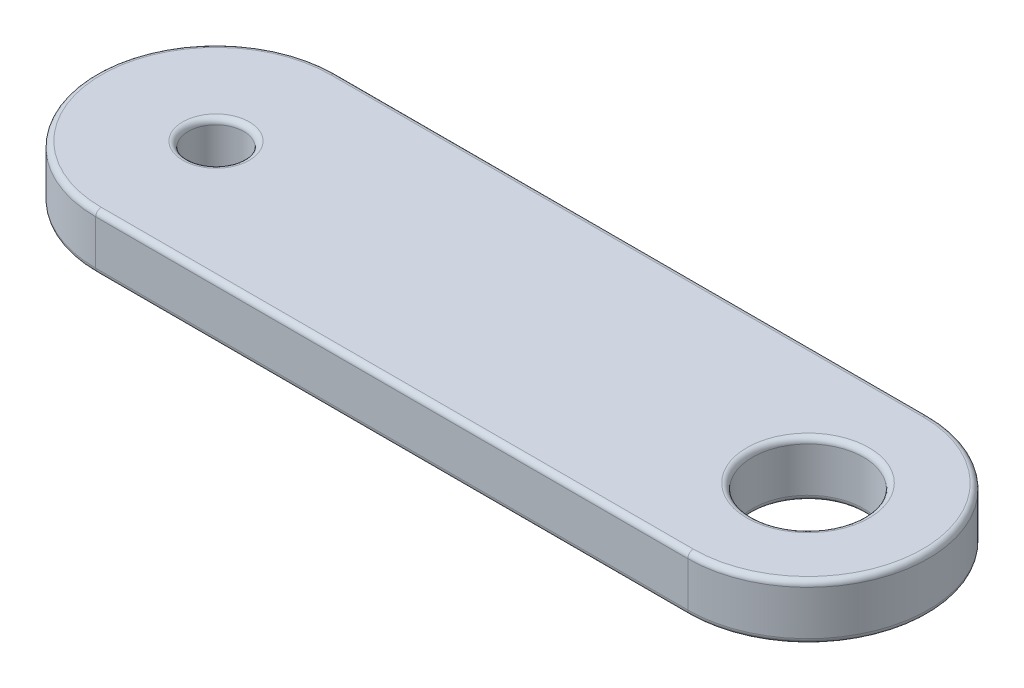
SolidWorks part; units mm, degrees
ref_plane "Front Plane" through (0, 0, 0) normal (0, 0, 1) x (1, 0, 0)
ref_plane "Top Plane" through (0, 0, 0) normal (0, 1, 0) x (1, 0, 0)
ref_plane "Right Plane" through (0, 0, 0) normal (1, 0, 0) x (0, 0, -1)
sketch "Sketch1" plane through (0, 0, 0) normal (0, 1, 0) x (1, 0, 0)
  line L0 (-8, 0) -> (8, 0) construction
  line L1 (-8, 3.25) -> (8, 3.25)
  line L2 (-8, -3.25) -> (8, -3.25)
  arc A0 (-8, 3.25) -> (-8, -3.25) centre (-8, 0) ccw
  arc A1 (8, -3.25) -> (8, 3.25) centre (8, 0) ccw
  circle A2 centre (-8, 0) radius 0.75
  circle A3 centre (8, 0) radius 1.5
  point P3 (0, 0)
  dimension "D1" = 1.5
  dimension "D3" = 6.5
  dimension "D4" = 3
  dimension "D2" = 16
extrude "Boss-Extrude1" add sketch "Sketch1" along normal mid plane 1.5
fillet "Fillet1" radius 0.15 12 edges at (8, -0.75, 1.5) (-8, -0.75, 0.75) (0, -0.75, 3.25) (11.25, -0.75, 0) (0, -0.75, -3.25) (-11.25, -0.75, 0) (8, 0.75, 1.5) (0, 0.75, -3.25) (11.25, 0.75, 0) (0, 0.75, 3.25) (-11.25, 0.75, 0) (-8, 0.75, 0.75)
